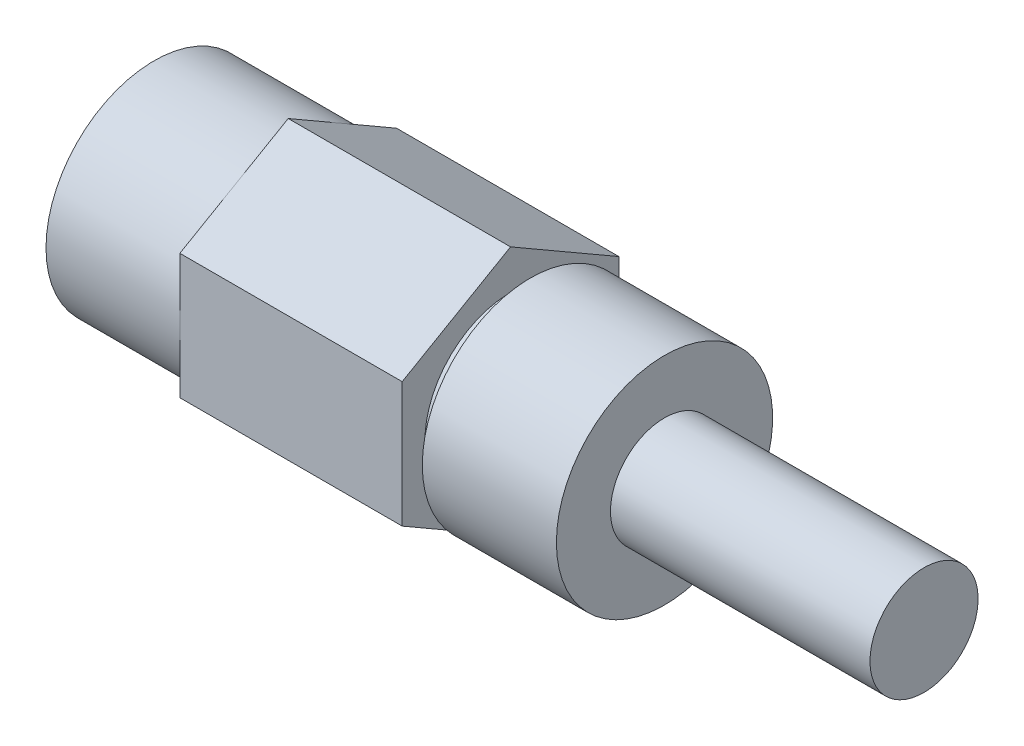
SolidWorks part; units mm, degrees
ref_plane "Front Plane" through (0, 0, 0) normal (0, 0, 1) x (1, 0, 0)
ref_plane "Top Plane" through (0, 0, 0) normal (0, 1, 0) x (1, 0, 0)
ref_plane "Right Plane" through (0, 0, 0) normal (1, 0, 0) x (0, 0, -1)
sketch "Sketch1" plane through (0, 0, 0) normal (0, 0, 1) x (1, 0, 0)
  line L0 (0, 0) -> (5803.9119, 0) construction
  line L1 (0, 0) -> (0, 6.35)
  line L2 (0, 6.35) -> (7.874, 6.35)
  line L3 (7.874, 6.35) -> (7.874, 6.3627)
  line L4 (7.874, 6.3627) -> (22.098, 6.3627)
  line L5 (22.098, 6.3627) -> (22.098, 6.35)
  line L6 (22.098, 6.35) -> (29.972, 6.35)
  line L7 (29.972, 6.35) -> (29.972, 3.175)
  line L8 (29.972, 3.175) -> (45.212, 3.175)
  line L9 (45.212, 3.175) -> (45.212, 0)
  line L10 (0, 0) -> (45.212, 0)
  dimension "D1" = 12.7254
  dimension "D2" = 12.7
  dimension "D3" = 6.35
  dimension "D4" = 14.224
  dimension "D5" = 15.24
  dimension "D6" = 7.874
revolve "Revolve1" add sketch "Sketch1" angle 360 about L0
sketch "Sketch2" plane through (22.098, 0, 0) normal (1, 0, 0) x (0, 0, -1)
  line L1 (-6.3627, 3.6735) -> (-6.3627, -3.6735)
  line L2 (-6.3627, -3.6735) -> (0, -7.347)
  line L3 (0, -7.347) -> (6.3627, -3.6735)
  line L4 (6.3627, -3.6735) -> (6.3627, 3.6735)
  line L5 (6.3627, 3.6735) -> (0, 7.347)
  line L6 (0, 7.347) -> (-6.3627, 3.6735)
  circle A0 centre (0, 0) radius 6.3627 construction
  circle A1 centre (0, 0) radius 6.3627 construction
extrude "Boss-Extrude1" add sketch "Sketch2" against normal up to surface (14.224 mm away)
ref_plane "Plane1" through (0, 0, 0) normal (0, 0, -1) x (-1, 0, 0)
sketch "Sketch4" plane through (0, 0, 0) normal (0, 0, -1) x (-1, 0, 0)
  line L0 (-7.874, 7.347) -> (-22.098, 7.347) construction
  line L1 (-22.098, 7.347) -> (-20.9296, 7.347)
  line L2 (-22.098, 7.347) -> (-22.098, 5.0292)
  line L3 (-22.098, 5.0292) -> (-20.9296, 5.0292)
  line L4 (-20.9296, 7.347) -> (-20.9296, 5.0292)
  line L5 (-28.5894, 0) -> (-5.4539, 0) construction
  line L6 (-22.098, 3.6735) -> (-22.098, 7.347) construction
  dimension "D1" = 10.0584
  dimension "D2" = 1.1684
  dimension "D3" = 0
revolve "Cut-Revolve2" cut sketch "Sketch4" angle 360 about L5
